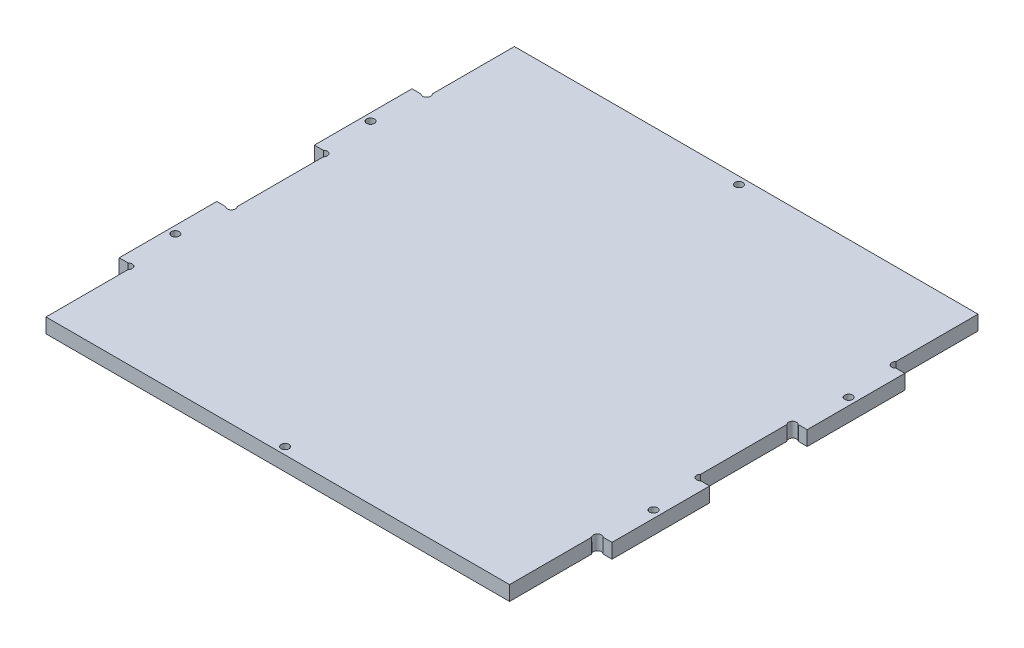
SolidWorks part; units mm, degrees
ref_plane "Plan de face" through (0, 0, 0) normal (0, 0, 1) x (1, 0, 0)
ref_plane "Plan de dessus" through (0, 0, 0) normal (0, 1, 0) x (1, 0, 0)
ref_plane "Plan de droite" through (0, 0, 0) normal (1, 0, 0) x (0, 0, -1)
sketch "Esquisse1" plane through (0, 0, 0) normal (0, 1, 0) x (1, 0, 0)
  line L0 (127.1599, 0) -> (-150.1289, 0) construction
  line L1 (0, -104.8827) -> (0, 116.6176) construction
  line L2 (101, -104.8827) -> (101, 116.6176) construction
  line L3 (-95, 96) -> (95, 96)
  line L4 (97.334, -20) -> (101, -20)
  line L5 (-95, -96) -> (95, -96)
  line L6 (101, 60) -> (101, 20)
  line L7 (118.9961, 96) -> (-13.8927, 96) construction
  line L8 (118.9961, 93) -> (-13.8927, 93) construction
  line L9 (95, -12.4531) -> (95, 103.7757) construction
  line L10 (115.418, 20) -> (86.4798, 20) construction
  line L11 (127.1599, 40) -> (83.9892, 40) construction
  line L12 (98, 47.1859) -> (98, 26.0735) construction
  line L13 (95, 20) -> (105.6902, 9.3098) construction
  line L14 (97.334, 20) -> (101, 20)
  line L15 (97.334, 60) -> (101, 60)
  line L16 (95, 62.334) -> (95, 96)
  line L17 (101, -60) -> (101, -20)
  line L18 (97.334, -60) -> (101, -60)
  line L19 (95, -62.334) -> (95, -96)
  line L20 (95, 17.666) -> (95, -17.666)
  line L21 (-95, -62.334) -> (-95, -96)
  line L22 (-97.334, -60) -> (-101, -60)
  line L23 (-101, -60) -> (-101, -20)
  line L24 (-97.334, -20) -> (-101, -20)
  line L25 (-95, 17.666) -> (-95, -17.666)
  line L26 (-97.334, 20) -> (-101, 20)
  line L27 (-101, 60) -> (-101, 20)
  line L28 (-97.334, 60) -> (-101, 60)
  line L29 (-95, 62.334) -> (-95, 96)
  arc A0 (97.334, 20) -> (95, 17.666) centre (96.167, 18.833) ccw
  circle A1 centre (98, 40) radius 1.6
  arc A2 (97.334, 60) -> (95, 62.334) centre (96.167, 61.167) cw
  circle A3 centre (98, -40) radius 1.6
  arc A4 (97.334, -20) -> (95, -17.666) centre (96.167, -18.833) cw
  arc A5 (97.334, -60) -> (95, -62.334) centre (96.167, -61.167) ccw
  circle A6 centre (-98, -40) radius 1.6
  arc A7 (-97.334, -60) -> (-95, -62.334) centre (-96.167, -61.167) cw
  arc A8 (-97.334, -20) -> (-95, -17.666) centre (-96.167, -18.833) ccw
  arc A9 (-97.334, 20) -> (-95, 17.666) centre (-96.167, 18.833) cw
  circle A10 centre (-98, 40) radius 1.6
  arc A11 (-97.334, 60) -> (-95, 62.334) centre (-96.167, 61.167) ccw
  circle A12 centre (0, 93) radius 1.6
  circle A13 centre (0, -93) radius 1.6
  point P5 (0, 0)
  dimension "D6" = 101
  dimension "D8" = 3
  dimension "D1" = 20
  dimension "D2" = 40
  dimension "D3" = 6
  dimension "D4" = 3
  dimension "D5" = 45
  dimension "D7" = 96
extrude "Boss.-Extru.1" add sketch "Esquisse1" along normal blind 6
